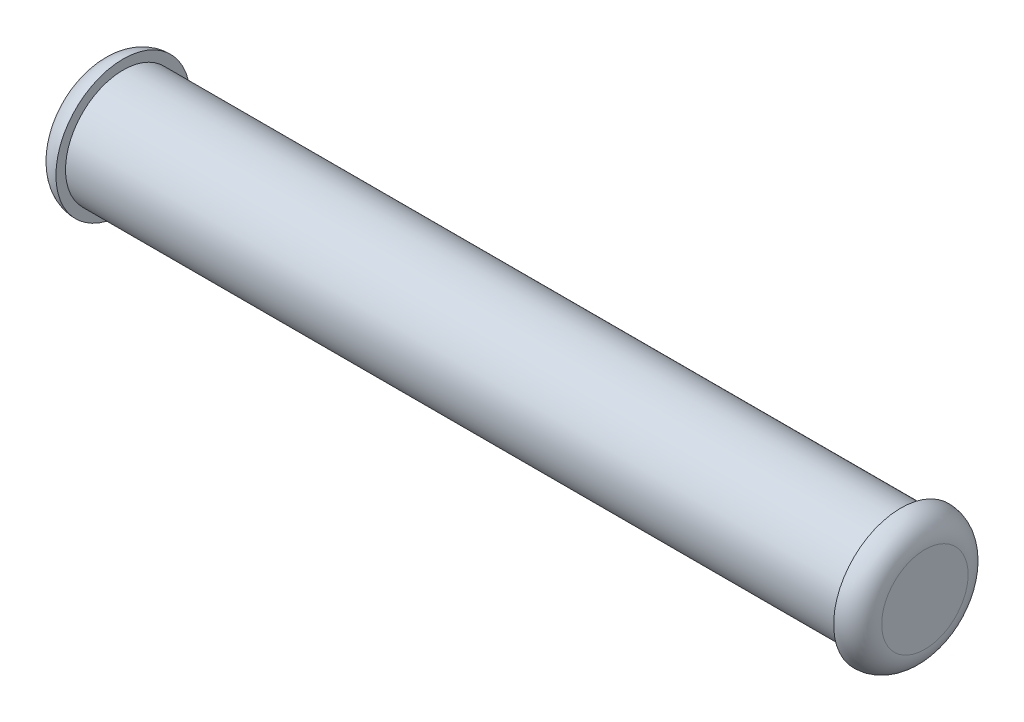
SolidWorks part; units mm, degrees
ref_plane "Спереди" through (0, 0, 0) normal (0, 0, 1) x (1, 0, 0)
ref_plane "Сверху" through (0, 0, 0) normal (0, 1, 0) x (1, 0, 0)
ref_plane "Справа" through (0, 0, 0) normal (1, 0, 0) x (0, 0, -1)
sketch "Эскиз1" plane through (0, 0, 0) normal (1, 0, 0) x (0, 0, -1)
  circle A0 centre (0, 0) radius 2.4
  dimension "D1" = 4.8
extrude "Бобышка-Вытянуть1" add sketch "Эскиз1" along normal mid plane 32.4
sketch "Эскиз2" plane through (16.2, 0, 0) normal (1, 0, 0) x (0, 0, -1)
  circle A0 centre (0, 0) radius 2.8
extrude "Бобышка-Вытянуть2" add sketch "Эскиз2" along normal blind 1
mirror "Зеркальное отражение1" about plane through (0, 0, 0) normal (1, 0, 0) of "Бобышка-Вытянуть2"
fillet "Скругление1" radius 1 2 edges at (-17.2, 0, -2.8) (17.2, 0, -2.8)
